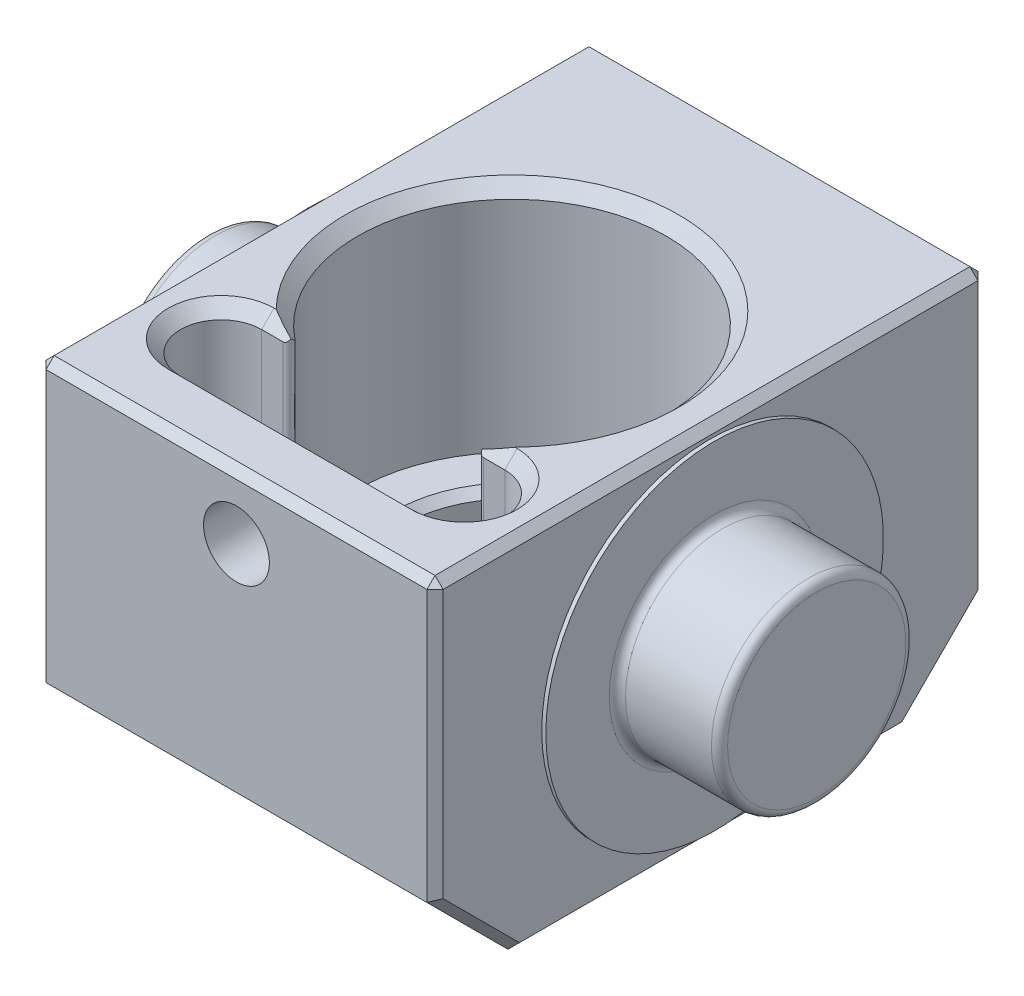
SolidWorks part; units mm, degrees
ref_plane "Front Plane" through (0, 0, 0) normal (0, 0, 1) x (1, 0, 0)
ref_plane "Top Plane" through (0, 0, 0) normal (0, 1, 0) x (1, 0, 0)
ref_plane "Right Plane" through (0, 0, 0) normal (1, 0, 0) x (0, 0, -1)
sketch "Sketch1" plane through (0, 0, 0) normal (1, 0, 0) x (0, 0, -1)
  line L1 (-17, 11.1125) -> (17, 11.1125)
  line L2 (-17, 11.1125) -> (-17, -11.1125)
  line L3 (-17, -11.1125) -> (17, -11.1125)
  line L4 (17, 11.1125) -> (17, -11.1125)
  line L5 (-17, 11.1125) -> (17, -11.1125) construction
  line L6 (-17, -11.1125) -> (17, 11.1125) construction
  point P0 (0, 0)
  dimension "D1" = 22.225
  dimension "D2" = 34
extrude "Boss-Extrude1" add sketch "Sketch1" along normal mid plane 24.5
sketch "Sketch2" plane through (0, 0, 0) normal (0, 0, 1) x (1, 0, 0)
  line L0 (0, 0) -> (15.0375, 0) construction
  line L1 (12.25, 10.414) -> (12.5, 10.414)
  line L2 (12.25, 11.1125) -> (12.25, -11.1125) construction
  line L3 (12.5, 10.414) -> (12.5, 6)
  line L4 (12.5, 6) -> (18.8, 6)
  line L5 (18.8, 6) -> (18.8, 0)
  line L6 (18.8, 0) -> (12.25, 0)
  line L7 (12.25, 0) -> (12.25, 10.414)
  line L8 (0, 10.193) -> (0, -1.9896) construction
  dimension "D1" = 20.828
  dimension "D2" = 25
  dimension "D3" = 12
  dimension "D4" = 37.6
revolve "Revolve1" add sketch "Sketch2" angle 360 about L0
mirror "Mirror1" about plane through (0, 0, 0) normal (1, 0, 0) of "Revolve1"
sketch "Sketch3" plane through (0, 0, 0) normal (0, 0, 1) x (1, 0, 0)
  line L0 (0, 11.1125) -> (0, -3.175)
  line L1 (12.25, 11.1125) -> (-12.25, 11.1125) construction
  line L2 (0, -3.175) -> (-9.5288, -3.175)
  line L3 (-9.5288, -3.175) -> (-9.5288, 11.1125)
  line L4 (-9.5288, 11.1125) -> (0, 11.1125)
  line L5 (0, 10.1247) -> (0, -4.0859) construction
  dimension "D1" = 19.0576
  dimension "D2" = 3.175
revolve "Cut-Revolve1" cut sketch "Sketch3" angle 360 about L5
sketch "Sketch4" plane through (0, 0, 0) normal (0, 0, 1) x (1, 0, 0)
  line L0 (0, -11.1125) -> (0, -3.175)
  line L1 (12.25, -11.1125) -> (-12.25, -11.1125) construction
  line L2 (0, -11.1125) -> (-6.731, -11.1125)
  line L3 (-6.731, -11.1125) -> (-6.731, -3.175)
  line L4 (9.5288, -3.175) -> (-9.5288, -3.175) construction
  line L5 (-6.731, -3.175) -> (0, -3.175)
  line L6 (0, -1.9252) -> (0, -10.0139) construction
  dimension "D1" = 13.462
revolve "Cut-Revolve2" cut sketch "Sketch4" angle 360 about L6
sketch "Sketch5" plane through (0, 11.1125, 0) normal (0, 1, 0) x (1, 0, 0)
  line L0 (-7.5, -10.4464) -> (7.5, -10.4464) construction
  line L1 (-7.5, -7.9464) -> (7.5, -7.9464)
  line L2 (-7.5, -12.9464) -> (7.5, -12.9464)
  line L3 (-1.1729, 0) -> (1.6976, 0) construction
  arc A0 (-7.5, -7.9464) -> (-7.5, -12.9464) centre (-7.5, -10.4464) ccw
  arc A1 (7.5, -12.9464) -> (7.5, -7.9464) centre (7.5, -10.4464) ccw
  circle A4 centre (0, 0) radius 9.5288 construction
  point P2 (0, -10.4464)
  dimension "D1" = 17.4752
  dimension "D2" = 7.9464
  dimension "D3" = 5
  dimension "D4" = 15
extrude "Cut-Extrude1" cut sketch "Sketch5" against normal blind 6.5
chamfer "Chamfer1" distance 5 angle 45 2 edges at (0, -11.1125, -17) (0, -11.1125, 17)
chamfer "Chamfer2" distance 0.5 angle 45 14 edges at (12.25, -8.6125, 14.5) (12.25, 2.5, 17) (12.25, -11.1125, 0) (12.25, -8.6125, -14.5) (12.25, 2.5, -17) (-12.25, 2.5, 17) (-12.25, -8.6125, 14.5) (-12.25, -11.1125, 0) (-12.25, -8.6125, -14.5) (-12.25, 2.5, -17) (0, 11.1125, -17) (12.25, 11.1125, 0) (0, 11.1125, 17) (-12.25, 11.1125, 0)
chamfer "Chamfer4" distance 0.762 angle 45 6 edges at (-6.3793, 11.1125, 7.9464) (-10, 11.1125, 10.4464) (0, 11.1125, 12.9464) (10, 11.1125, 10.4464) (6.3793, 11.1125, 7.9464) (0, 11.1125, -9.5288)
fillet "Fillet1" radius 0.3 2 edges at (5.2586, 7.4815, 7.9464) (-5.2586, 7.4815, 7.9464)
chamfer "Chamfer5" distance 0.5 angle 45 2 edges at (0, -3.175, 6.731) (0, -11.1125, 6.731)
fillet "Fillet2" radius 0.5 2 edges at (-18.8, 0, 6) (18.8, 0, 6)
fillet "Fillet3" radius 0.5 2 edges at (12.5, 0, 6) (-12.5, 0, 6)
sketch "Sketch9" plane through (0, 0, 17) normal (0, 0, 1) x (1, 0, 0)
  line L0 (0, 4.6125) -> (0, 11.1125) construction
  line L1 (-7.5, 4.6125) -> (7.5, 4.6125) construction
  line L2 (-11.75, 11.1125) -> (11.75, 11.1125) construction
  circle A0 centre (0, 7.1725) radius 2.032
  circle A1 centre (0, 7.1725) radius 3.3274 construction
  dimension "D1" = 4.064
  dimension "D2" = 6.6548
  dimension "D3" = 3.94
extrude "Cut-Extrude2" cut sketch "Sketch9" against normal up to next
